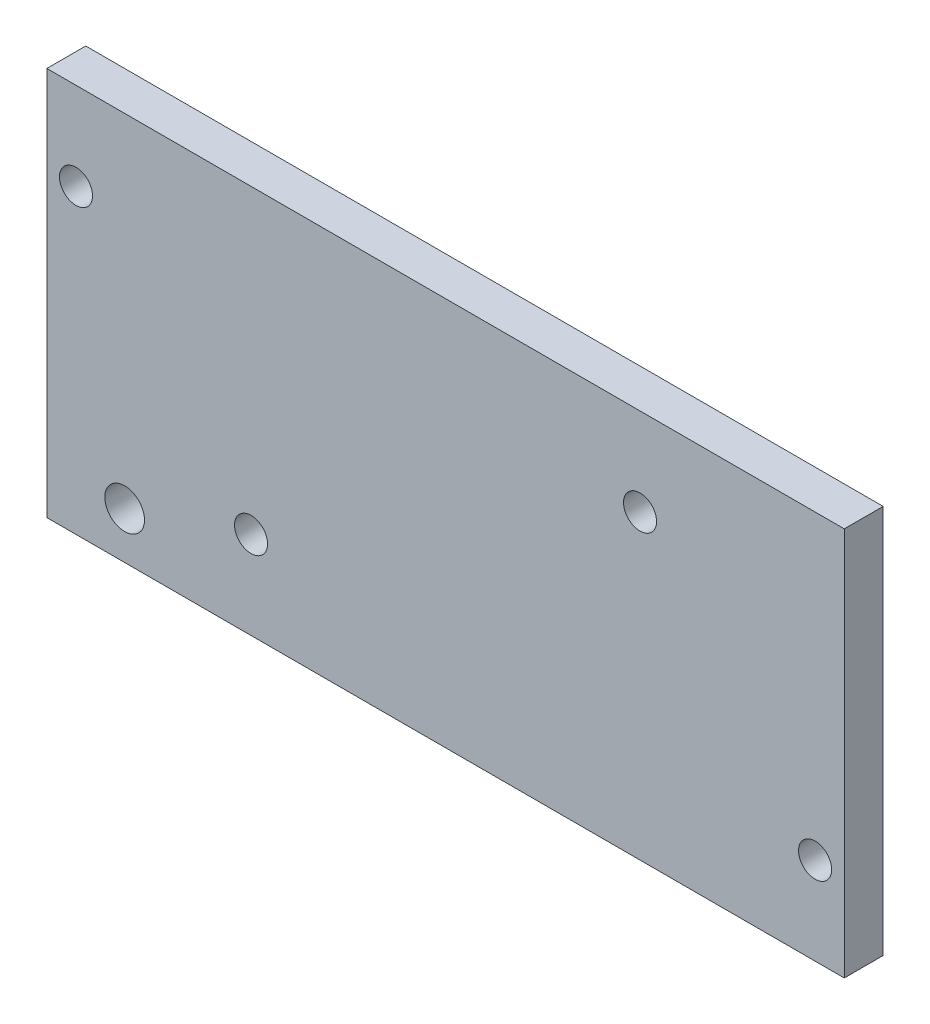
SolidWorks part; units mm, degrees
ref_plane "Plan de face" through (0, 0, 0) normal (0, 0, 1) x (1, 0, 0)
ref_plane "Plan de dessus" through (0, 0, 0) normal (0, 1, 0) x (1, 0, 0)
ref_plane "Plan de droite" through (0, 0, 0) normal (1, 0, 0) x (0, 0, -1)
sketch "Esquisse1" plane through (0, 0, 0) normal (1, 0, 0) x (0, 0, -1)
  line L1 (0, 0) -> (10, 0)
  line L2 (0, 0) -> (0, 100)
  line L3 (0, 100) -> (10, 100)
  line L4 (10, 0) -> (10, 100)
  dimension "D1" = 100
  dimension "D2" = 10
extrude "Extrusion1" add sketch "Esquisse1" along normal blind 205
hole_wizard "Diamètre du perçage M8.5 (8.500000)1" positions "Esquisse3" profile "Esquisse2" hole size "M8.5" standard "ISO"
sketch "Esquisse3" plane through (0, 0, 0) normal (0, 0, 1) x (1, 0, 0)
  line L0 (205, 100) -> (0, 100) construction
  line L1 (0, 100) -> (0, 0) construction
  line L2 (205, 100) -> (205, 0) construction
  point P0 (7.5, 77.5)
  point P1 (152.5, 77.5)
  point P3 (52.5, 22.5)
  point P5 (197.5, 22.5)
  dimension "D1" = 55
  dimension "D2" = 22.5
  dimension "D3" = 7.5
  dimension "D4" = 45
  dimension "D5" = 45
  dimension "D6" = 7.5
sketch "Esquisse2" plane through (7.5, 77.5, 0) normal (1, 0, 0) x (0, -1, 0)
  line L0 (0, 0) -> (0, 10)
  line L1 (0, 10) -> (4.25, 10)
  line L2 (4.25, 10) -> (4.25, 0)
  line L5 (4.25, 0) -> (0, 0)
  line L11 (0, -6.35) -> (0, 107.95) construction
  dimension "Diamètre du perçage jusqu'au prochain" = 8.5
  dimension "Profondeur du perçage jusqu'au prochain" = 10
hole_wizard "Trou taraudé M12x1.751" positions "Esquisse5" profile "Esquisse4" tap size "M12x1.75" standard "ISO"
sketch "Esquisse5" plane through (0, 0, 0) normal (0, 0, 1) x (1, 0, 0)
  line L0 (0, 100) -> (0, 0) construction
  line L2 (205, 0) -> (0, 0) construction
  point P0 (20, 12)
  dimension "D1" = 20
  dimension "D2" = 12
sketch "Esquisse4" plane through (20, 12, 0) normal (1, 0, 0) x (0, -1, 0)
  line L0 (0, 0) -> (0, 10)
  line L1 (0, 10) -> (5.1, 10)
  line L2 (5.1, 10) -> (5.1, 0)
  line L5 (5.1, 0) -> (0, 0)
  line L11 (0, -6.35) -> (0, 107.95) construction
  dimension "Diamètre du trou pour taraudage jusqu'au prochain" = 10.2
  dimension "Profondeur du trou pour taraudage jusqu'au prochain" = 10
